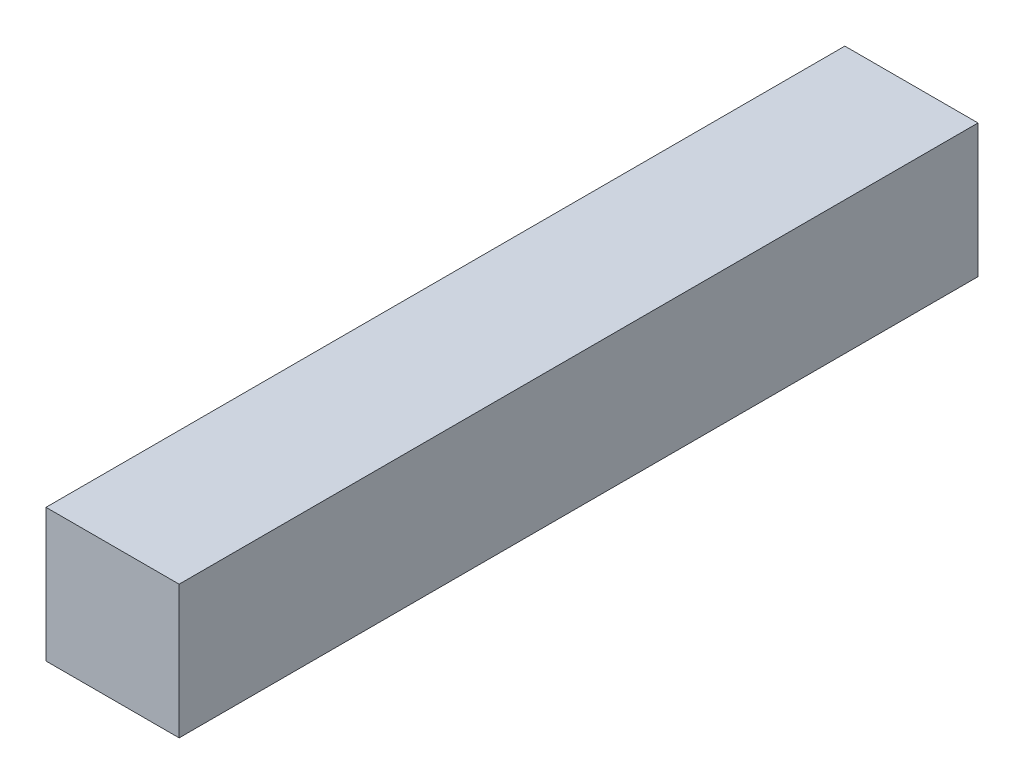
SolidWorks part; units mm, degrees
ref_plane "Face" through (0, 0, 0) normal (0, 0, 1) x (1, 0, 0)
ref_plane "Dessus" through (0, 0, 0) normal (0, 1, 0) x (1, 0, 0)
ref_plane "Droite" through (0, 0, 0) normal (1, 0, 0) x (0, 0, -1)
sketch "Esquisse1" plane through (0, 0, 0) normal (0, 0, 1) x (1, 0, 0)
  line L1 (0, 0) -> (25, 0)
  line L2 (0, 0) -> (0, 25)
  line L3 (0, 25) -> (25, 25)
  line L4 (25, 0) -> (25, 25)
  dimension "D1" = 25
  dimension "D2" = 25
extrude "Extrusion1" add sketch "Esquisse1" along normal blind 150
